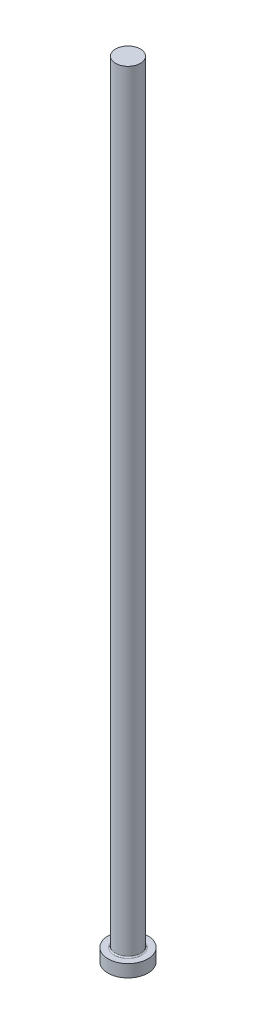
SolidWorks part; units mm, degrees
ref_plane "Plano frontal" through (0, 0, 0) normal (0, 0, 1) x (1, 0, 0)
ref_plane "Plano superior" through (0, 0, 0) normal (0, 1, 0) x (1, 0, 0)
ref_plane "Plano direito" through (0, 0, 0) normal (1, 0, 0) x (0, 0, -1)
sketch "Esboço1" plane through (0, 0, 0) normal (0, 0, 1) x (1, 0, 0)
  line L0 (0, 0) -> (8, 0)
  line L1 (8, 0) -> (8, 5)
  line L2 (8, 5) -> (5.5, 5)
  line L3 (5, 5.5) -> (5, 315)
  line L4 (5, 315) -> (0, 315)
  line L5 (0, 315) -> (0, 0) construction
  line L6 (0, 0) -> (0, 315)
  arc A0 (5.5, 5) -> (5, 5.5) centre (5.5, 5.5) cw
  dimension "D3" = 0.5
  dimension "D1" = 16
  dimension "D2" = 10
  dimension "D4" = 5
  dimension "D5" = 315
revolve "Revolução1" add sketch "Esboço1" angle 360 about L5
sketch "Esboço2"
  dimension "D1" = 0.9
  dimension "D2" = 1.4
  dimension "D3" = 4.3
  dimension "D4" = 0.6
wrap "Envolver1" sketch "Esboço2" wrap type deboss source sketch "Esboço2" thickness 0.1 parameters "D1"=0.1
